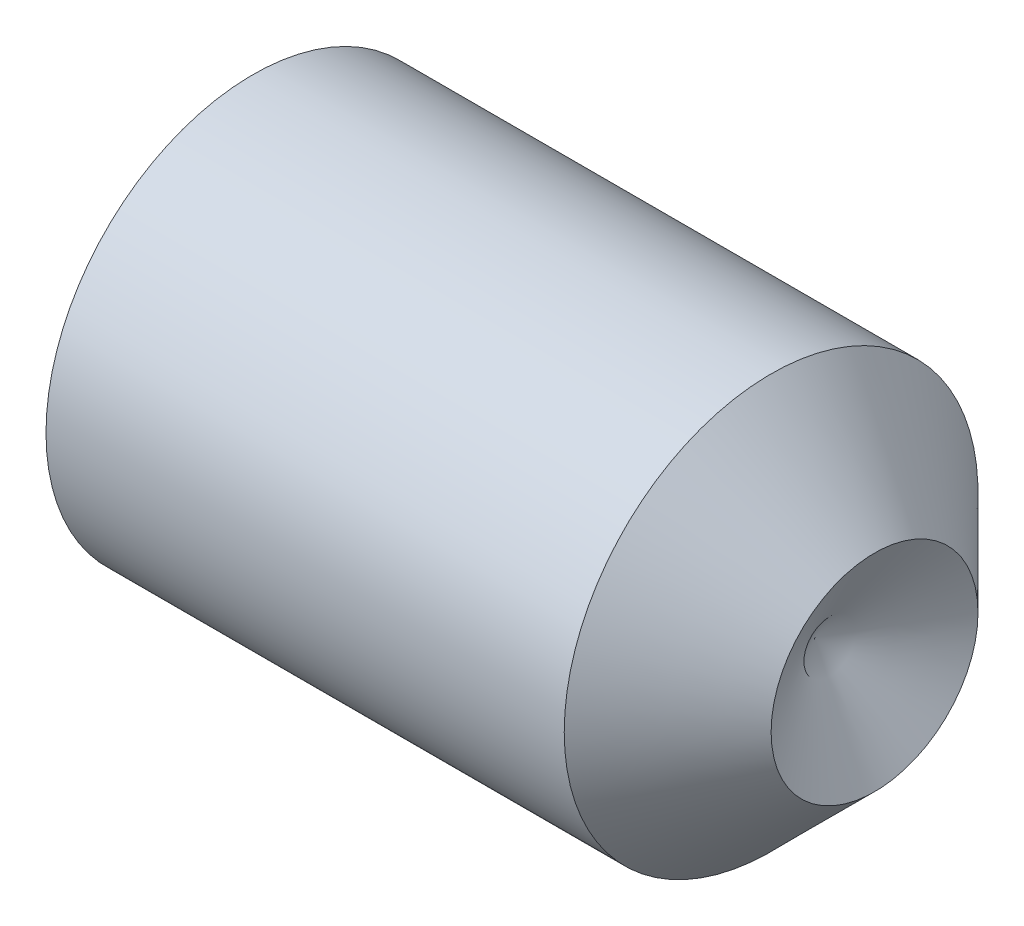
SolidWorks part; units mm, degrees
ref_plane "Plane1" through (0, 0, 0) normal (0, 0, 1) x (1, 0, 0)
ref_plane "Plane2" through (0, 0, 0) normal (0, 1, 0) x (1, 0, 0)
ref_plane "Plane3" through (0, 0, 0) normal (1, 0, 0) x (0, 0, -1)
sketch "BodySke" plane through (0, 0, 0) normal (0, 0, 1) x (1, 0, 0)
  line L0 (0, 0) -> (0, 1.655)
  line L1 (0, 1.655) -> (0.4879, 2.5)
  line L2 (0.4879, 2.5) -> (6.75, 2.5)
  line L3 (6.75, 2.5) -> (8, 1.25)
  line L4 (7.2783, 0) -> (0, 0)
  line L5 (-12.7, 0) -> (88.9, 0) construction
  line L6 (7.2783, 0) -> (8, 1.25)
  line L7 (8, 1.25) -> (8, 10.775) construction
  line L8 (0, -1.655) -> (0.4879, -2.5) construction
  line L9 (7.2783, 0) -> (8, -1.25) construction
  line L10 (6.75, -2.5) -> (8, -1.25) construction
  line L11 (0.4, 15.875) -> (0.4, -3.175) construction
  dimension "Length" = 8
  dimension "Diameter" = 5
  dimension "Drive_ch_ang" = 60
  dimension "Minor_dia" = 3.31
  dimension "Cup_nose_ang" = 45
  dimension "Cup_ang" = 120
  dimension "Cup_dia" = 2.5
  dimension "Advance" = 0.8
revolve "BaseBody" add sketch "BodySke" angle 360 about L5
sketch "Sketch2" plane through (0, 0, 0) normal (-1, 0, 0) x (0, 0, 1)
  line L0 (0.7217, 1.25) -> (-0.7217, 1.25)
  line L1 (-0.7217, 1.25) -> (-1.4434, 0)
  line L2 (0.7217, 1.25) -> (1.4434, 0)
  line L3 (0.7217, -1.25) -> (1.4434, 0)
  line L4 (0.7217, -1.25) -> (-0.7217, -1.25)
  line L5 (-0.7217, -1.25) -> (-1.4434, 0)
  dimension "Hex_size" = 2.5
  dimension "D2" = 1.25
  dimension "D3" = 1.25
extrude "Hex" cut sketch "Sketch2" against normal blind 3
sketch "ThdSchSke" plane through (0, 0, 0) normal (0, 0, 1) x (1, 0, 0)
  line L0 (0.4879, -1.655) -> (-0.1038, -2.5)
  line L1 (0.4879, -1.655) -> (1.0795, -2.5)
  line L2 (1.0795, -2.5) -> (1.0795, -3.125)
  line L3 (-3.175, 0) -> (5.1513, 0) construction
  line L4 (0.4879, 2.5) -> (0.4879, -2.5) construction
  line L5 (1.0795, -3.125) -> (-0.1038, -3.125)
  line L6 (-0.1038, -3.125) -> (-0.1038, -2.5)
  dimension "Thread_minor" = 3.31
  dimension "Diameter" = 5
  dimension "SideAngle" = 55
  dimension "VeeAngle" = 70
  dimension "Overcut" = 6.25
revolve "ThreadSchematic" [suppressed] cut sketch "ThdSchSke" angle 360 about L3
pattern_linear "ThdSchPat" [suppressed]
equation "\"D2@Sketch2\" = \"Hex_size@Sketch2\" / 2"
equation "\"D3@Sketch2\" = \"Hex_size@Sketch2\" / 2"
equation "\"Thread_minor@ThreadCosmetic\" = \"Minor_dia@BodySke\""
equation "\"Thread_minor@ThdSchSke\" = \"Thread_minor@ThreadCosmetic\""
equation "\"Diameter@ThdSchSke\" = \"Diameter@BodySke\""
equation "\"Overcut@ThdSchSke\" = \"Diameter@BodySke\" * 1.25"
equation "\"Num_threads@ThdSchPat\" = int( (\"Length@BodySke\" - ( ( ( \"Diameter@BodySke\" - \"Minor_dia@BodySke\" ) * 0.5 ) / tan( \"Drive_ch_ang@BodySke\" * 0.017453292 ) ) - ( ( ( \"Diameter@BodySke\" - \"Cup_dia@BodySk"
equation "\"Advance@ThdSchPat\" = (\"Length@BodySke\" - ( ( ( \"Diameter@BodySke\" - \"Minor_dia@BodySke\" ) * 0.5 ) / tan( \"Drive_ch_ang@BodySke\" * 0.017453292 ) ) - ( ( ( \"Diameter@BodySke\" - \"Cup_dia@BodySke\" ) * 0."
equation "' \"Num_threads@ThdSchPat\" = \"Num_threads@ThdSchPat\" - sgn( \"Num_threads@ThdSchPat\" - 1) '---chamfered tips only---"
